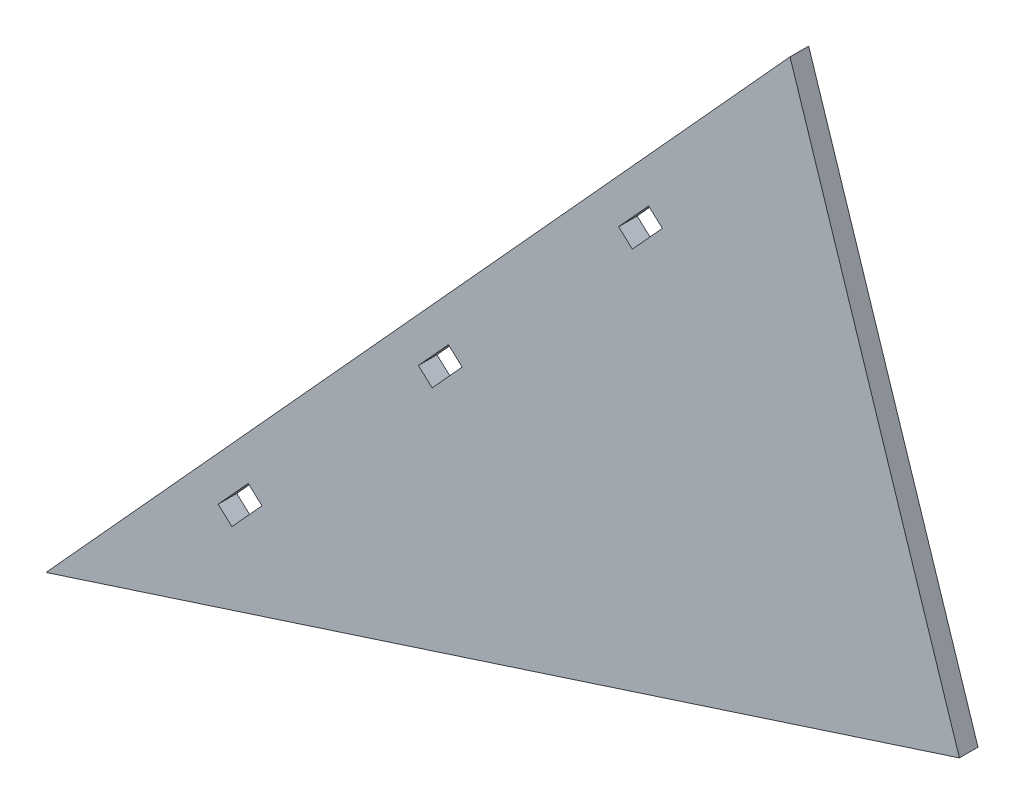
SolidWorks part; units mm, degrees
ref_plane "前视基准面" through (0, 0, 0) normal (0, 0, 1) x (1, 0, 0)
ref_plane "上视基准面" through (0, 0, 0) normal (0, 1, 0) x (1, 0, 0)
ref_plane "右视基准面" through (0, 0, 0) normal (1, 0, 0) x (0, 0, -1)
sketch "草图1" plane through (0, 0, 0) normal (0, 0, 1) x (1, 0, 0)
  line L11 (98.7438, 97.2545) -> (-1.2491, -12.7519)
  line L13 (75.6996, 65.9557) -> (79.7353, 70.3956)
  line L14 (75.6996, 65.9557) -> (77.5495, 64.2742)
  line L15 (77.5495, 64.2742) -> (81.5853, 68.7141)
  line L16 (79.7353, 70.3956) -> (81.5853, 68.7141)
  line L17 (48.7946, 36.3564) -> (52.8303, 40.7963)
  line L18 (48.7946, 36.3564) -> (50.6445, 34.6748)
  line L19 (50.6445, 34.6748) -> (54.6803, 39.1147)
  line L20 (52.8303, 40.7963) -> (54.6803, 39.1147)
  line L21 (98.7438, 97.2545) -> (-1.2491, -12.7519) construction
  line L22 (21.8896, 6.7571) -> (25.9253, 11.197)
  line L23 (21.8896, 6.7571) -> (23.7395, 5.0755)
  line L24 (23.7395, 5.0755) -> (27.7753, 9.5154)
  line L25 (25.9253, 11.197) -> (27.7753, 9.5154)
  line L26 (98.7438, 97.2545) -> (121.504, 27.0374)
  line L27 (121.504, 27.0374) -> (-1.2491, -12.7519)
  point P13 (121.504, 27.0374)
  point P19 (0, 0)
  dimension "D3" = 6
  dimension "D4" = 2.5
  dimension "D5" = 4
  dimension "D6" = 3
  dimension "D7" = 40
  dimension "D9" = 30
extrude "凸台-拉伸1" add sketch "草图1" along normal blind 2.5
